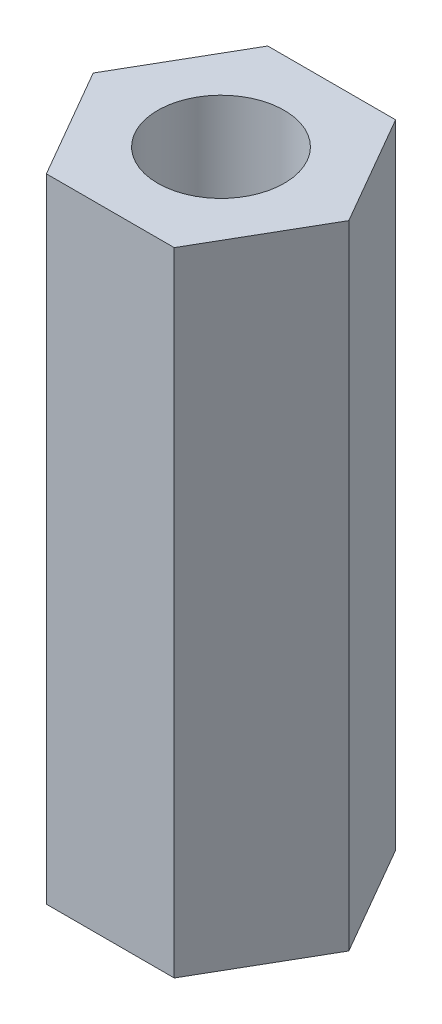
SolidWorks part; units mm, degrees
ref_plane "Front Plane" through (0, 0, 0) normal (0, 0, 1) x (1, 0, 0)
ref_plane "Top Plane" through (0, 0, 0) normal (0, 1, 0) x (1, 0, 0)
ref_plane "Right Plane" through (0, 0, 0) normal (1, 0, 0) x (0, 0, -1)
sketch "Sketch1" plane through (0, 0, 0) normal (0, 1, 0) x (1, 0, 0)
  line L1 (2.0207, 3.5) -> (-2.0207, 3.5)
  line L2 (-2.0207, 3.5) -> (-4.0415, 0)
  line L3 (-4.0415, 0) -> (-2.0207, -3.5)
  line L4 (-2.0207, -3.5) -> (2.0207, -3.5)
  line L5 (2.0207, -3.5) -> (4.0415, 0)
  line L6 (4.0415, 0) -> (2.0207, 3.5)
  circle A0 centre (0, 0) radius 3.5 construction
  circle A1 centre (0, 0) radius 2
  dimension "D2" = 4
  dimension "D1" = 7
extrude "Boss-Extrude1" add sketch "Sketch1" along normal blind 20
